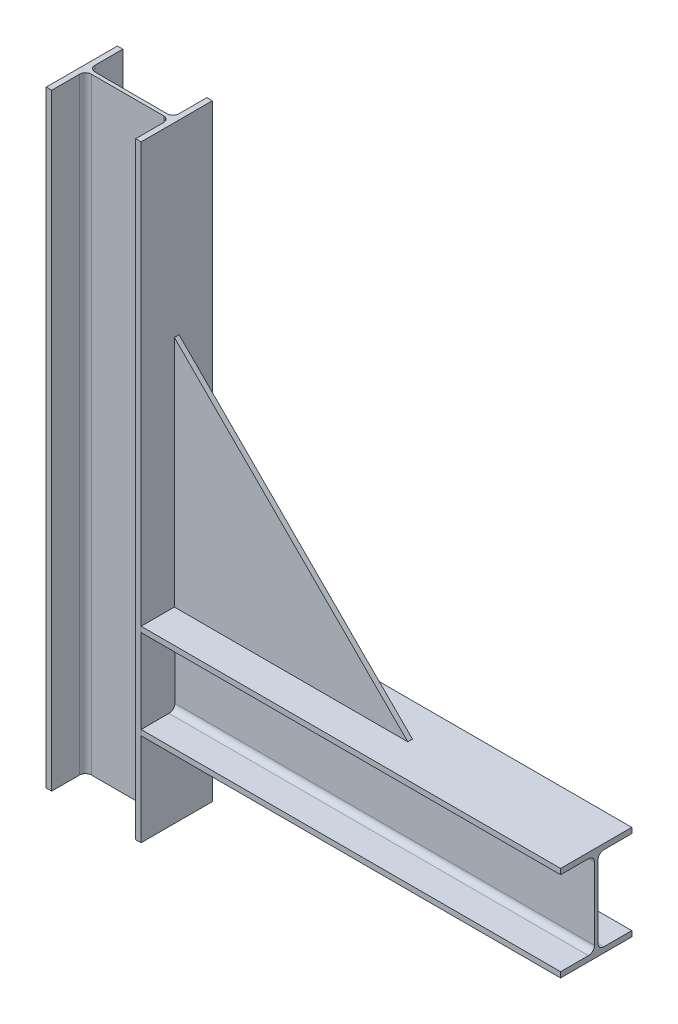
SolidWorks part; units mm, degrees
ref_plane "Front Plane" through (0, 0, 0) normal (0, 0, 1) x (1, 0, 0)
ref_plane "Top Plane" through (0, 0, 0) normal (0, 1, 0) x (1, 0, 0)
ref_plane "Right Plane" through (0, 0, 0) normal (1, 0, 0) x (0, 0, -1)
sketch "Sketch1" plane through (0, 0, 0) normal (0, 0, 1) x (1, 0, 0)
  line L0 (0, 500) -> (0, -150)
  line L1 (0, 0) -> (500, 0)
  dimension "D1" = 500
  dimension "D2" = 500
  dimension "D3" = 150
ref_plane "Plane1" through (0, 500, 0) normal (0, -1, 0) x (1, 0, 0)
ref_plane "Plane2" through (0, 500, 0) normal (0, -1, 0) x (1, 0, 0)
other "Al i beam AL I BEAM 4X2.31(1)"
ref_plane "Plane3" through (0, 500, 0) normal (0, -1, 0) x (0, 0, 1)
sketch "Sketch12" plane through (0, 500, 0) normal (0, -1, 0) x (0, 0, 1)
  line L0 (-38.1, -50.8) -> (-38.1, -44.958)
  line L1 (-38.1, -44.958) -> (-8.255, -44.958)
  line L2 (-1.905, -38.608) -> (-1.905, 38.608)
  line L3 (-8.255, 44.958) -> (-38.1, 44.958)
  line L4 (-38.1, 44.958) -> (-38.1, 50.8)
  line L5 (-38.1, 50.8) -> (38.1, 50.8)
  line L6 (38.1, 50.8) -> (38.1, 44.958)
  line L7 (38.1, 44.958) -> (8.255, 44.958)
  line L8 (1.905, 38.608) -> (1.905, -38.608)
  line L9 (8.255, -44.958) -> (38.1, -44.958)
  line L10 (38.1, -44.958) -> (38.1, -50.8)
  line L11 (38.1, -50.8) -> (-38.1, -50.8)
  line L12 (1.905, 0) -> (-1.905, 0) construction
  arc A0 (-8.255, -44.958) -> (-1.905, -38.608) centre (-8.255, -38.608) ccw
  arc A1 (-1.905, 38.608) -> (-8.255, 44.958) centre (-8.255, 38.608) ccw
  arc A2 (8.255, 44.958) -> (1.905, 38.608) centre (8.255, 38.608) ccw
  arc A3 (1.905, -38.608) -> (8.255, -44.958) centre (8.255, -38.608) ccw
  point P20 (0, 50.8)
  point P23 (0.282, 0)
  point P25 (0, -50.8)
  point P26 (0, 0)
  point P27 (0, 0)
  dimension "Ri" = 6.35
  dimension "Tw" = 3.81
  dimension "Bf" = 76.2
  dimension "Depth" = 101.6
  dimension "Tf" = 5.842
other "Gusset1" parameters "D1"=5, "D2"=5, "D3"=0, "D4"=0, "D10"=5, "D11"=250, "D12"=250, "D13"=15, "D14"=45, "D15"=15, "D16"=125, "D17"=125, "D18"=45
sketch "Sketch13" plane through (50.8, 50.8, 0) normal (0, 0, 1) x (1, 0, 0)
  line L0 (0, 0) -> (0, 250)
  line L1 (0, 0) -> (250, 0)
  line L2 (0, 250) -> (250, 0)
